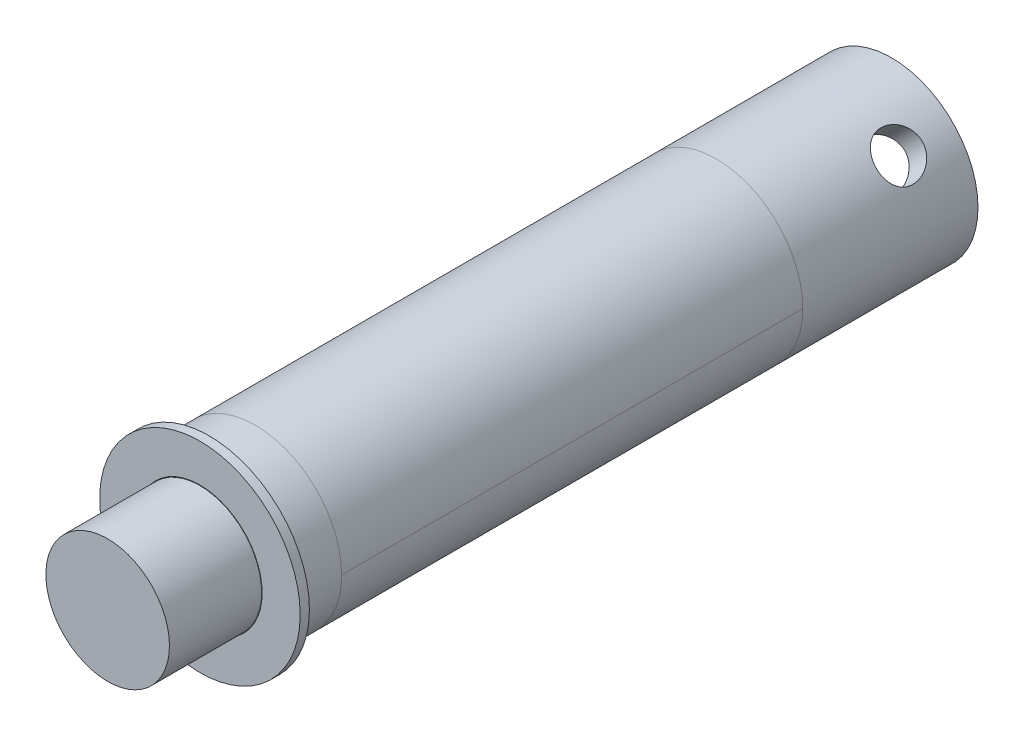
SolidWorks part; units mm, degrees
ref_plane "Front Plane" through (0, 0, 0) normal (0, 0, 1) x (1, 0, 0)
ref_plane "Top Plane" through (0, 0, 0) normal (0, 1, 0) x (1, 0, 0)
ref_plane "Right Plane" through (0, 0, 0) normal (1, 0, 0) x (0, 0, -1)
sketch "Sketch1" plane through (0, 0, 0) normal (0, 0, 1) x (1, 0, 0)
  circle A0 centre (0, 0) radius 23.8125
  circle A1 centre (0, 0) radius 17.145
  dimension "D1" = 34.29
  dimension "D2" = 47.625
extrude "Boss-Extrude1" add sketch "Sketch1" along normal blind 190.5
sketch "Sketch2" plane through (0, 0, 190.5) normal (0, 0, 1) x (1, 0, 0)
  circle A0 centre (0, 0) radius 21.2725
  circle A1 centre (0, 0) radius 27.6225
  dimension "D1" = 6.35
extrude "Boss-Extrude2" add sketch "Sketch2" against normal blind 2.54
sketch "Sketch3" plane through (0, 0, 190.5) normal (0, 0, 1) x (1, 0, 0)
  circle A0 centre (0, 0) radius 17.018
extrude "Boss-Extrude3" add sketch "Sketch3" along normal blind 25.4 separate body
sketch "Sketch5" plane through (0, 0, 0) normal (0, 1, 0) x (1, 0, 0)
  line L0 (27.6225, -187.96) -> (-27.6225, -187.96) construction
  line L1 (-30.9526, -175.26) -> (30.9526, -175.26)
  line L2 (-30.9526, -175.26) -> (-30.9526, -48.26)
  line L3 (-30.9526, -48.26) -> (30.9526, -48.26)
  line L4 (30.9526, -175.26) -> (30.9526, -48.26)
  line L5 (-30.9526, -175.26) -> (30.9526, -48.26) construction
  line L6 (-30.9526, -48.26) -> (30.9526, -175.26) construction
  point P0 (0, -111.76)
  dimension "D1" = 12.7
  dimension "D2" = 127
hole_wizard "1/2 (0.5) Diameter Slot1" positions "3DSketch1" profile "Sketch7" size "1/2" standard "ANSI Inch"
sketch3d "3DSketch1"
  point P7 (17.0407, 16.6328, 14.9218)
sketch "Sketch7" plane through (17.0407, 16.6328, 14.9218) normal (0, 0, 1) x (-0.6985, 0.7156, 0)
  line L0 (0, 0) -> (0, 62.8737)
  line L1 (0, 62.8737) -> (6.35, 62.8737)
  line L2 (6.35, 62.8737) -> (6.35, 0)
  line L5 (6.35, 0) -> (0, 0)
  line L11 (0, -6.35) -> (0, 107.95) construction
  dimension "Thru Hole Dia." = 12.7
  dimension "Thru Hole Depth" = 62.8737
sketch "Sketch8" plane through (0, 0, 0) normal (0, 0, -1) x (-1, 0, 0)
  line L0 (-23.8125, 0) -> (23.8125, 0)
  circle A0 centre (0, 0) radius 23.8125 construction
